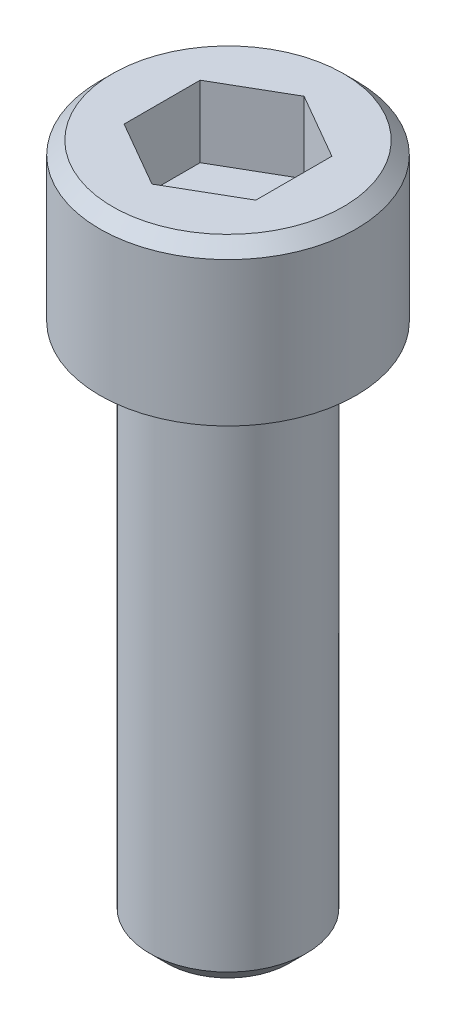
SolidWorks part; units mm, degrees
ref_plane "Front" through (0, 0, 0) normal (0, 0, 1) x (1, 0, 0)
ref_plane "Top" through (0, 0, 0) normal (0, 1, 0) x (1, 0, 0)
ref_plane "Right" through (0, 0, 0) normal (1, 0, 0) x (0, 0, -1)
sketch "Sketch1" plane through (0, 0, 0) normal (0, 0, 1) x (1, 0, 0)
  line L0 (0, 0) -> (2.3241, 0)
  line L1 (2.3241, 0) -> (2.3241, 2.6124)
  line L2 (2.3241, 2.6124) -> (2.0917, 2.8448)
  line L3 (2.0917, 2.8448) -> (0, 2.8448)
  line L4 (0, 2.8448) -> (0, 0)
  line L5 (0, 0) -> (0, 100) construction
revolve "Base-Revolve" add sketch "Sketch1" angle 360 about L5
sketch "Sketch2" plane through (0, 0, 0) normal (0, 0, 1) x (1, 0, 0)
  line L0 (0, 0) -> (0, 100) construction
  line L1 (0, -9.525) -> (1.1062, -9.525)
  line L2 (1.1062, -9.525) -> (1.4224, -9.2088)
  line L3 (1.4224, -9.2088) -> (1.4224, 0)
  line L4 (1.4224, 0) -> (0, 0)
  line L5 (0, 0) -> (0, -9.525)
revolve "Boss-Revolve1" add sketch "Sketch2" angle 360 about L0
ref_plane "Plane4" through (0, 2.8448, 0) normal (0, 1, 0) x (-1, 0, 0)
sketch "Sketch3" plane through (0, 2.8448, 0) normal (0, 1, 0) x (-1, 0, 0)
  line L0 (1.1938, 0.6892) -> (0, 1.3785)
  line L1 (0, 1.3785) -> (-1.1938, 0.6892)
  line L2 (-1.1938, 0.6892) -> (-1.1938, -0.6892)
  line L3 (-1.1938, -0.6892) -> (0, -1.3785)
  line L4 (0, -1.3785) -> (1.1938, -0.6892)
  line L5 (1.1938, -0.6892) -> (1.1938, 0.6892)
extrude "Cut-Extrude1" cut sketch "Sketch3" against normal blind 1.2954
